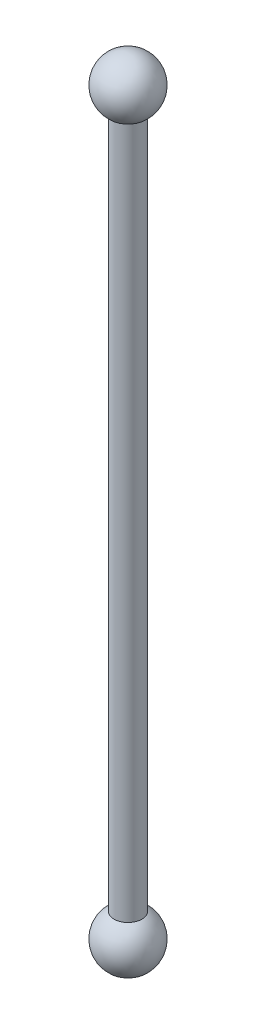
SolidWorks part; units mm, degrees
ref_plane "正面" through (0, 0, 0) normal (0, 0, 1) x (1, 0, 0)
ref_plane "平面" through (0, 0, 0) normal (0, 1, 0) x (1, 0, 0)
ref_plane "右側面" through (0, 0, 0) normal (1, 0, 0) x (0, 0, -1)
sketch "ｽｹｯﾁ1" plane through (0, 0, 0) normal (0, 0, 1) x (1, 0, 0)
  line L0 (0, 67.9312) -> (0, -76.3385) construction
  line L1 (0, 15) -> (0, -15)
  arc A0 (0, 15) -> (0, -15) centre (0, 0) cw
  dimension "D1" = 15
revolve "回転3" add sketch "ｽｹｯﾁ1" angle 360 about L0
sketch "ｽｹｯﾁ2" plane through (0, 0, 0) normal (0, 1, 0) x (1, 0, 0)
  circle A0 centre (0, 0) radius 7.5
  dimension "D1" = 15
extrude "押し出し1" add sketch "ｽｹｯﾁ2" along normal blind 400
sketch "ｽｹｯﾁ3" plane through (0, 0, 0) normal (0, 0, 1) x (1, 0, 0)
  line L0 (0, 425.9979) -> (0, 374.0021) construction
  line L1 (0, 415) -> (0, 385)
  arc A0 (0, 415) -> (0, 385) centre (0, 400) cw
  dimension "D1" = 15
  dimension "D2" = 400
revolve "回転4" add sketch "ｽｹｯﾁ3" angle 360 about L0
